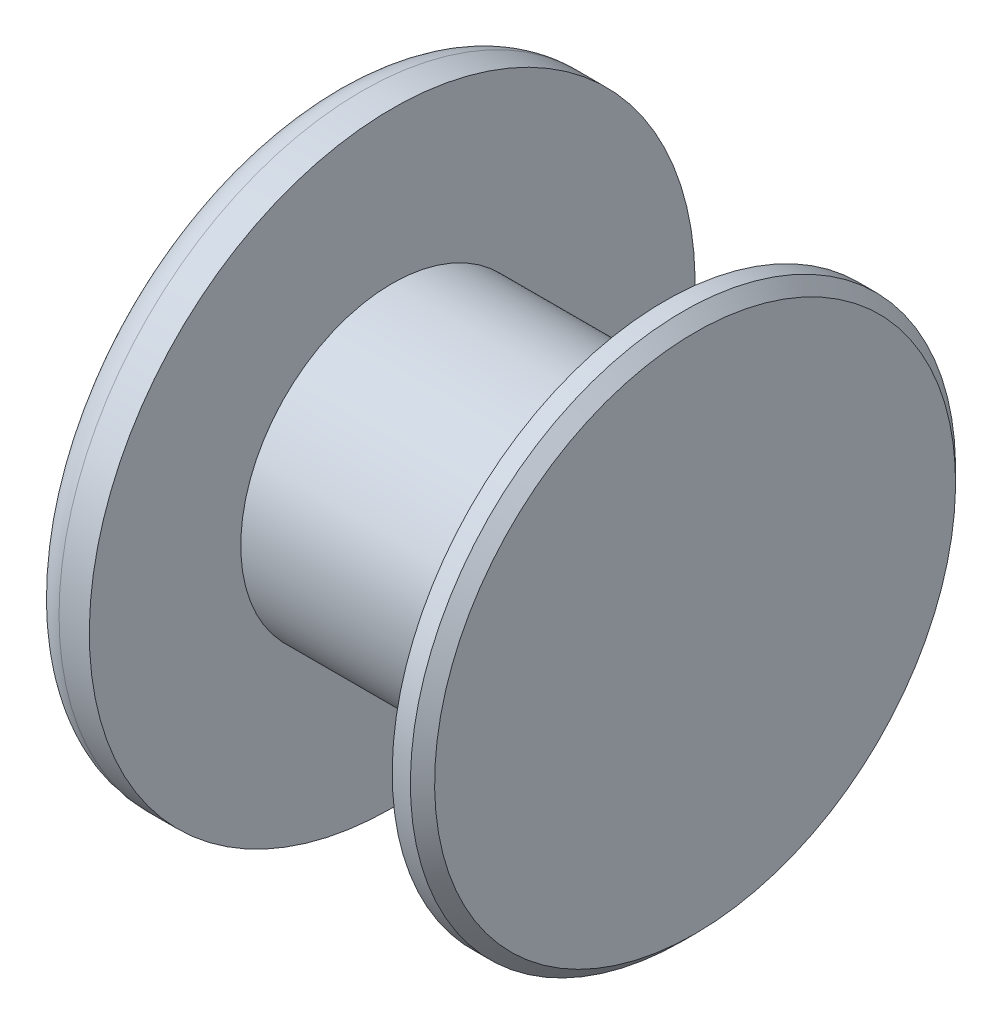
SolidWorks part; units mm, degrees
ref_plane "Plan de face" through (0, 0, 0) normal (0, 0, 1) x (1, 0, 0)
ref_plane "Plan de dessus" through (0, 0, 0) normal (0, 1, 0) x (1, 0, 0)
ref_plane "Plan de droite" through (0, 0, 0) normal (1, 0, 0) x (0, 0, -1)
sketch "Esquisse1" plane through (0, 0, 0) normal (0, 0, 1) x (1, 0, 0)
  line L0 (-3, 0) -> (3, 0) construction
  line L1 (-3, 0) -> (-3, 5)
  line L2 (-3, 5) -> (-2, 5)
  line L3 (-2, 5) -> (-2, 2.5)
  line L4 (-2, 2.5) -> (2.5, 2.5)
  line L5 (2.5, 2.5) -> (2.5, 4.5)
  line L6 (2.5, 4.5) -> (3, 4.5)
  line L7 (3, 4.5) -> (3, 0)
  line L8 (3, 0) -> (-3, 0)
  point P4 (0, 0)
  dimension "D1" = 6
  dimension "D2" = 1
  dimension "D3" = 0.5
  dimension "D4" = 2.5
  dimension "D5" = 4.5
  dimension "D6" = 5
revolve "Révolution1" add sketch "Esquisse1" angle 360 about L0
fillet "Congé1" radius 0.5 1 edges at (-3, -5, 0)
chamfer "Chanfrein1" distance 0.2 angle 45 1 edges at (3, -4.5, 0)
